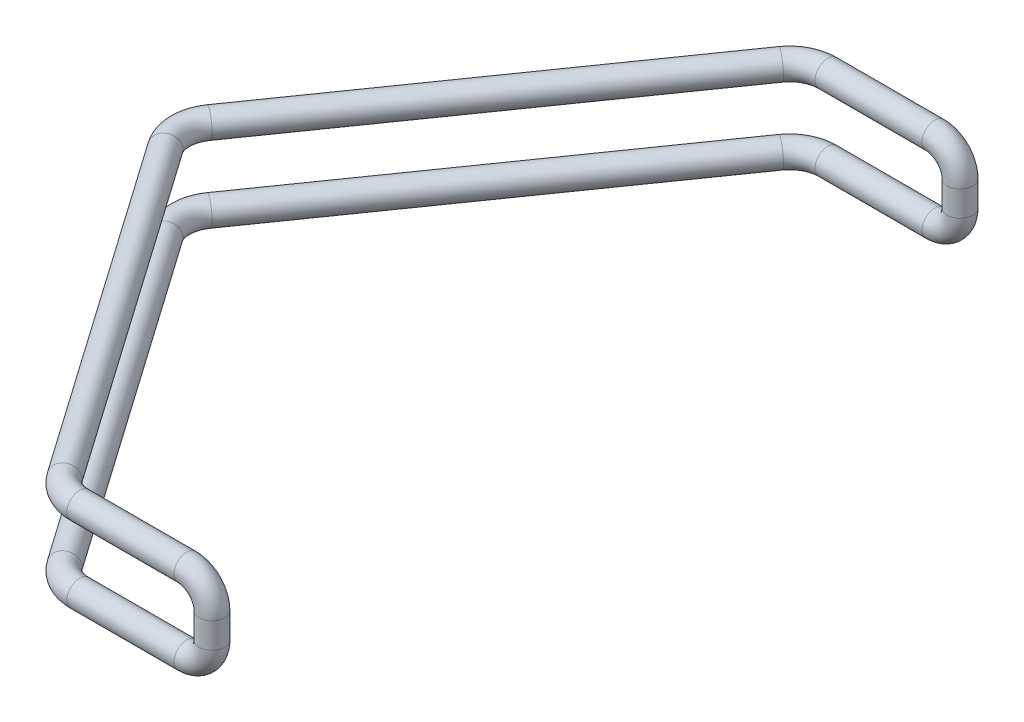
SolidWorks part; units mm, degrees
ref_plane "Front Plane" through (0, 0, 0) normal (0, 0, 1) x (1, 0, 0)
ref_plane "Top Plane" through (0, 0, 0) normal (0, 1, 0) x (1, 0, 0)
ref_plane "Right Plane" through (0, 0, 0) normal (1, 0, 0) x (0, 0, -1)
sketch3d "3DSketch1"
  line L0 (0, 0, 0) -> (0, 3.175, 0)
  line L1 (-6.35, 9.525, 0) -> (-33.1416, 9.525, 0)
  line L2 (-40.944, 9.525, 4.0617) -> (-99.8343, 9.525, 88.1658)
  line L3 (-99.8343, 9.525, 99.0924) -> (-40.944, 9.525, 183.1965)
  line L4 (-33.1416, 9.525, 187.2582) -> (-6.35, 9.525, 187.2582)
  line L5 (0, 3.175, 187.2582) -> (0, 0, 187.2582)
  arc A0 (-99.8343, 9.525, 99.0924) -> (-99.8343, 9.525, 88.1658) centre (-92.0319, 9.525, 93.6291) ccw
  arc A1 (-33.1416, 9.525, 0) -> (-40.944, 9.525, 4.0617) centre (-33.1416, 9.525, 9.525) ccw
  arc A2 (-33.1416, 9.525, 187.2582) -> (-40.944, 9.525, 183.1965) centre (-33.1416, 9.525, 177.7332) ccw
  arc A3 (0, 3.175, 0) -> (-6.35, 9.525, 0) centre (-6.35, 3.175, 0) ccw
  arc A4 (0, 3.175, 187.2582) -> (-6.35, 9.525, 187.2582) centre (-6.35, 3.175, 187.2582) ccw
  point P10 (-103.6598, 9.525, 93.6291)
  point P11 (-92.0319, 0, 93.6291)
  point P14 (-38.1, 9.525, 0)
  point P15 (-33.1416, 19.05, 9.525)
  point P18 (-38.1, 9.525, 187.2582)
  point P19 (-33.1416, 0, 177.7332)
  point P22 (0, 9.525, 0)
  point P23 (-6.35, 3.175, 6.35)
  point P26 (0, 9.525, 187.2582)
  point P27 (-6.35, 3.175, 193.6082)
  dimension "D9" = 9.525
  dimension "D10" = 6.35
  dimension "D1" = 9.525
  dimension "D2" = 38.1
  dimension "D3" = 114.3
  dimension "D4" = 114.3
  dimension "D5" = 38.1
  dimension "D6" = 9.525
  dimension "D7" = 125
  dimension "D8" = 125
sketch "Sketch1" plane through (0, 0, 0) normal (0, 1, 0) x (1, 0, 0)
  circle A0 centre (0, 0) radius 3.175
sweep "Sweep1" add profiles "Sketch1" path "3DSketch1"
mirror "Mirror1" about plane through (0, 0, 0) normal (0, 1, 0) of "Sweep1"
